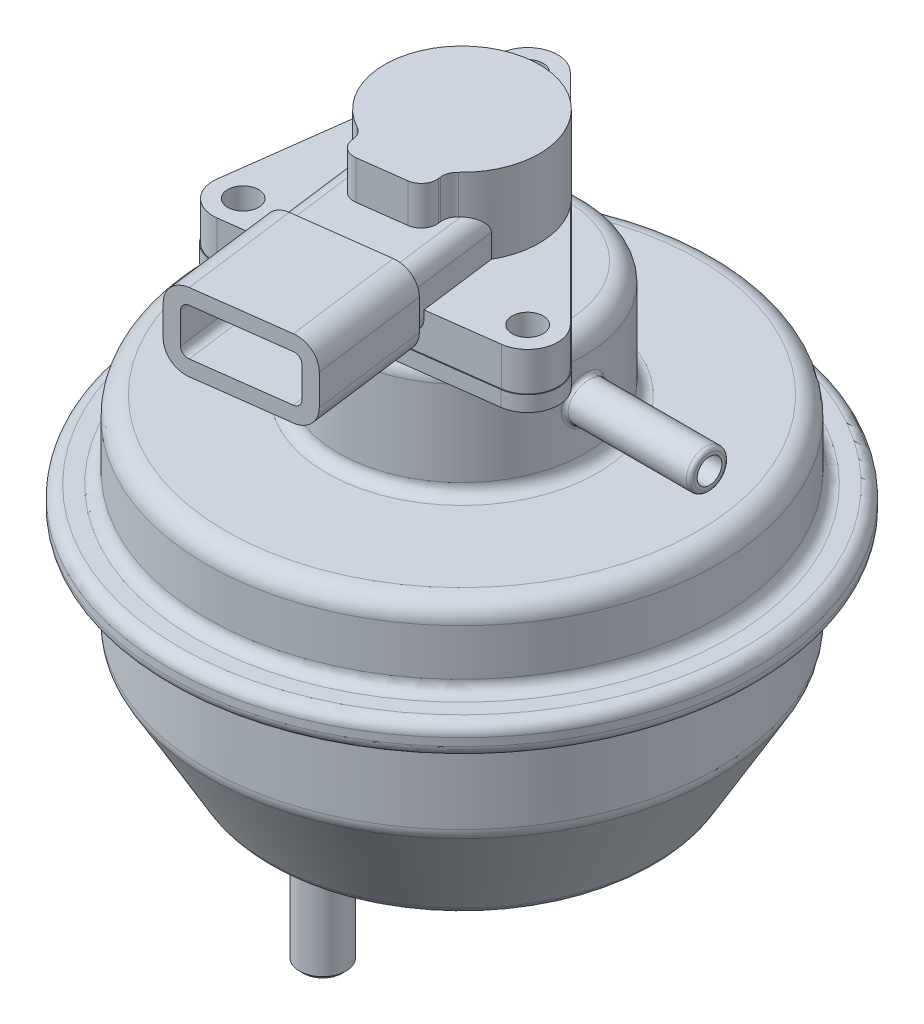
SolidWorks part; units mm, degrees
ref_plane "Plan de face" through (0, 0, 0) normal (0, 0, 1) x (1, 0, 0)
ref_plane "Plan de dessus" through (0, 0, 0) normal (0, 1, 0) x (1, 0, 0)
ref_plane "Plan de droite" through (0, 0, 0) normal (1, 0, 0) x (0, 0, -1)
sketch "Esquisse1" plane through (0, 0, 0) normal (0, 0, 1) x (1, 0, 0)
  line L0 (0, -17.0631) -> (0, 71.3623) construction
  line L1 (0, 0) -> (9, 0)
  line L2 (9, 0) -> (9, 8)
  line L3 (9, 8) -> (24.3397, 8)
  line L4 (24.3397, 8) -> (33, 23)
  line L5 (33, 23) -> (33, 37)
  line L6 (33, 37) -> (35, 37)
  line L7 (35, 37) -> (35, 35)
  line L8 (35, 35) -> (38, 35)
  line L9 (38, 35) -> (38, 39)
  line L10 (38, 39) -> (33, 39)
  line L11 (33, 39) -> (33, 49)
  line L12 (33, 49) -> (16, 49)
  line L13 (16, 49) -> (16, 64)
  line L14 (16, 64) -> (0, 64)
  line L15 (0, 64) -> (0, 63)
  line L16 (0, 63) -> (15, 63)
  line L17 (15, 63) -> (15, 48)
  line L18 (15, 48) -> (32, 48)
  line L19 (32, 48) -> (32, 23.2679)
  line L20 (32, 23.2679) -> (23.7624, 9)
  line L21 (23.7624, 9) -> (0, 9)
  line L22 (0, 9) -> (0, 0)
  dimension "D1" = 66
  dimension "D2" = 1
  dimension "D3" = 1
  dimension "D4" = 1
  dimension "D5" = 1
  dimension "D6" = 1
  dimension "D7" = 1
  dimension "D8" = 2
  dimension "D9" = 2
  dimension "D10" = 5
  dimension "D11" = 4
  dimension "D12" = 32
  dimension "D13" = 41
  dimension "D14" = 8
  dimension "D15" = 18
  dimension "D16" = 15
  dimension "D17" = 15
  dimension "D18" = 10
  dimension "D19" = 30
revolve "Révolution1" add sketch "Esquisse1" angle 360 about L0
fillet "Congé1" radius 1.5 10 edges at (0, 48, -32) (0, 63, -15) (0, 37, -33) (0, 8, -9) (0, 9, -23.7624) (0, 23.2679, -32) (0, 39, -33) (0, 49, -16) (0, 35, -38) (0, 39, -38)
fillet "Congé2" radius 2.5 6 edges at (0, 0, -9) (0, 8, -24.3397) (0, 23, -33) (0, 49, -33) (0, 48, -15) (0, 64, -16)
sketch "Esquisse2" plane through (0, 0, 0) normal (0, -1, 0) x (1, 0, 0)
  circle A0 centre (0, 0) radius 5.5
  dimension "D1" = 11
extrude "Enlèv. mat.-Extru.1" cut sketch "Esquisse2" against normal blind 1
sketch "Esquisse3" plane through (0, 1, 0) normal (0, -1, 0) x (1, 0, 0)
  circle A0 centre (0, 0) radius 3
  dimension "D1" = 6
extrude "Enlèv. mat.-Extru.2" cut sketch "Esquisse3" against normal up to next
ref_plane "Plan1" through (32, 0, 0) normal (1, 0, 0) x (0, 0, -1)
sketch "Esquisse4" plane through (32, 0, 0) normal (1, 0, 0) x (0, 0, -1)
  line L0 (13.5, 64) -> (-13.5, 64) construction
  circle A0 centre (0, 56.5) radius 2.5
  dimension "D1" = 5
  dimension "D2" = 7.5
extrude "Extrusion1" add sketch "Esquisse4" against normal up to next
sketch "Esquisse5" plane through (32, 0, 0) normal (1, 0, 0) x (0, 0, -1)
  circle A0 centre (0, 56.5) radius 1.6
  dimension "D1" = 3.2
extrude "Enlèv. mat.-Extru.3" cut sketch "Esquisse5" against normal up to next
fillet "Congé3" radius 0.5 2 edges at (15.8127, 55.959, 2.4408) (32, 56.5, -2.5)
sketch "Esquisse7" plane through (0, 0, 0) normal (1, 0, 0) x (0, 0, -1)
  line L0 (6.0798, 25.209) -> (27.2265, 13) construction
  line L1 (41.8, 0) -> (-41.8, 0) construction
  line L2 (25.0614, 9.25) -> (32.6651, 22.4199) construction
  line L3 (-22.8964, 8) -> (22.8964, 8) construction
  line L4 (24.6284, 14.5) -> (25.8784, 16.6651)
  line L5 (25.8784, 16.6651) -> (31.0746, 13.6651)
  line L6 (31.0746, 13.6651) -> (29.8246, 11.5)
  line L7 (29.8246, 11.5) -> (24.6284, 14.5)
  dimension "D1" = 30
  dimension "D2" = 5
  dimension "D3" = 2.5
  dimension "D4" = 3
  dimension "D5" = 6
revolve "Enlèvement de matière-Révolution1" cut sketch "Esquisse7" angle 360 about L0
sketch "Esquisse8" plane through (0, 8, 0) normal (0, -1, 0) x (1, 0, 0)
  line L0 (0, 18) -> (0, -18) construction
  circle A0 centre (0, 18) radius 3
  circle A1 centre (0, -18) radius 3
  dimension "D1" = 6
  dimension "D2" = 6
  dimension "D3" = 36
extrude "Extrusion2" add sketch "Esquisse8" along normal blind 13.5
chamfer "Chanfrein1" distance 0.5 angle 45 2 edges at (0, -5.5, -21) (0, -5.5, 15)
sketch "Esquisse9" plane through (0, 64, 0) normal (0, 1, 0) x (-1, 0, 0)
  line L0 (9.8995, -18.3848) -> (-18.3848, 9.8995) construction
  line L1 (38.225, 0) -> (-38.225, 0) construction
  line L2 (-4.2426, -4.2426) -> (14.1421, 14.1421) construction
  line L3 (7.0711, -21.2132) -> (-21.2132, 7.0711)
  line L4 (-18.9021, 13.8659) -> (13.6248, 18.1085)
  line L5 (18.1085, 13.6248) -> (13.8659, -18.9021)
  arc A0 (7.0711, -21.2132) -> (13.8659, -18.9021) centre (9.8995, -18.3848) ccw
  arc A1 (-18.9021, 13.8659) -> (-21.2132, 7.0711) centre (-18.3848, 9.8995) ccw
  arc A2 (18.1085, 13.6248) -> (13.6248, 18.1085) centre (14.1421, 14.1421) ccw
  circle A5 centre (-18.3848, 9.8995) radius 2
  circle A6 centre (14.1421, 14.1421) radius 2
  circle A7 centre (9.8995, -18.3848) radius 2
  dimension "D2" = 40
  dimension "D3" = 20
  dimension "D4" = 4
  dimension "D5" = 4
  dimension "D6" = 4
  dimension "D8" = 4
  dimension "D9" = 4
  dimension "D10" = 4
  dimension "D1" = 45
  dimension "D7" = 6
extrude "Extrusion3" add sketch "Esquisse9" along normal blind 2
sketch "Esquisse10" plane through (0, 66, 0) normal (0, 1, 0) x (-1, 0, 0)
  line L6 (-21.1425, 7.1418) -> (7.1418, -21.1425)
  line L7 (13.7667, -18.8892) -> (18.0094, 13.6377)
  line L8 (13.6377, 18.0094) -> (-18.8892, 13.7667)
  line L9 (-21.1425, 7.1418) -> (7.1418, -21.1425)
  line L10 (13.7667, -18.8892) -> (18.0094, 13.6377)
  line L11 (13.6377, 18.0094) -> (-18.8892, 13.7667)
  circle A0 centre (14.1421, 14.1421) radius 2 construction
  circle A1 centre (-18.3848, 9.8995) radius 2 construction
  circle A2 centre (9.8995, -18.3848) radius 2 construction
  circle A9 centre (14.1421, 14.1421) radius 2
  circle A10 centre (-18.3848, 9.8995) radius 2
  circle A11 centre (9.8995, -18.3848) radius 2
  arc A12 (-18.8892, 13.7667) -> (-21.1425, 7.1418) centre (-18.3848, 9.8995) ccw
  arc A13 (7.1418, -21.1425) -> (13.7667, -18.8892) centre (9.8995, -18.3848) ccw
  arc A14 (18.0094, 13.6377) -> (13.6377, 18.0094) centre (14.1421, 14.1421) ccw
  arc A15 (-18.8892, 13.7667) -> (-21.1425, 7.1418) centre (-18.3848, 9.8995) ccw
  arc A16 (7.1418, -21.1425) -> (13.7667, -18.8892) centre (9.8995, -18.3848) ccw
  arc A17 (18.0094, 13.6377) -> (13.6377, 18.0094) centre (14.1421, 14.1421) ccw
  dimension "D1" = 0.1
extrude "Extrusion4" add sketch "Esquisse10" along normal blind 5
sketch "Esquisse11" plane through (0, 71, 0) normal (0, 1, 0) x (-1, 0, 0)
  line L0 (0, 0) -> (-2.0816, 15.959) construction
  line L3 (13.6377, 18.0094) -> (-18.8892, 13.7667) construction
  line L4 (13.6377, 18.0094) -> (-18.8892, 13.7667) construction
  line L5 (-6.0781, 7.9408) -> (-6.5101, 11.2525)
  line L6 (-6.5101, 11.2525) -> (3.4059, 12.5459)
  line L7 (3.4059, 12.5459) -> (3.8379, 9.2342)
  arc A0 (-6.0781, 7.9408) -> (3.8379, 9.2342) centre (0, 0) ccw
  dimension "D1" = 20
  dimension "D2" = 10
  dimension "D3" = 12
extrude "Extrusion5" add sketch "Esquisse11" along normal blind 10
fillet "Congé4" radius 2 4 edges at (6.0781, 76, 7.9408) (6.5101, 76, 11.2525) (-3.4059, 76, 12.5459) (-3.8379, 76, 9.2342)
sketch "Esquisse12" plane through (2.0816, 0, 15.959) normal (0.1293, 0, 0.9916) x (0.9916, 0, -0.1293)
  line L0 (-15.8525, 66) -> (16.95, 66) construction
  line L1 (-8, 76) -> (8, 76)
  line L2 (-8, 76) -> (-8, 68)
  line L3 (-8, 68) -> (8, 68)
  line L4 (8, 76) -> (8, 68)
  line L5 (0, 0) -> (0, 76) construction
  dimension "D1" = 16
  dimension "D2" = 8
  dimension "D3" = 2
extrude "Extrusion6" add sketch "Esquisse12" against normal up to next and the other way blind 2
fillet "Congé5" radius 2 4 edges at (10.1438, 68, 15.9159) (-5.7219, 68, 17.9853) (9.491, 76, 10.9112) (-6.3746, 76, 12.9806)
sketch "Esquisse13" plane through (2.3403, 0, 17.9422) normal (0.1293, 0, 0.9916) x (0.9916, 0, -0.1293)
  line L8 (6, 77) -> (-6, 77)
  line L9 (-9, 74) -> (-9, 70)
  line L10 (-6, 67) -> (6, 67)
  line L11 (9, 70) -> (9, 74)
  line L12 (6, 77) -> (-6, 77)
  line L13 (-9, 74) -> (-9, 70)
  line L14 (-6, 67) -> (6, 67)
  line L15 (9, 70) -> (9, 74)
  line L20 (-7, 74) -> (-7, 70)
  line L21 (-6, 69) -> (6, 69)
  line L22 (7, 70) -> (7, 74)
  line L23 (6, 75) -> (-6, 75)
  line L24 (-7, 74) -> (-7, 70)
  line L25 (-6, 69) -> (6, 69)
  line L26 (7, 70) -> (7, 74)
  line L27 (6, 75) -> (-6, 75)
  arc A8 (-6, 77) -> (-9, 74) centre (-6, 74) ccw
  arc A9 (-9, 70) -> (-6, 67) centre (-6, 70) ccw
  arc A10 (6, 67) -> (9, 70) centre (6, 70) ccw
  arc A11 (9, 74) -> (6, 77) centre (6, 74) ccw
  arc A12 (-6, 77) -> (-9, 74) centre (-6, 74) ccw
  arc A13 (-9, 70) -> (-6, 67) centre (-6, 70) ccw
  arc A14 (6, 67) -> (9, 70) centre (6, 70) ccw
  arc A15 (9, 74) -> (6, 77) centre (6, 74) ccw
  arc A20 (-6, 75) -> (-7, 74) centre (-6, 74) ccw
  arc A21 (-7, 70) -> (-6, 69) centre (-6, 70) ccw
  arc A22 (6, 69) -> (7, 70) centre (6, 70) ccw
  arc A23 (7, 74) -> (6, 75) centre (6, 74) ccw
  arc A24 (-6, 75) -> (-7, 74) centre (-6, 74) ccw
  arc A25 (-7, 70) -> (-6, 69) centre (-6, 70) ccw
  arc A26 (6, 69) -> (7, 70) centre (6, 70) ccw
  arc A27 (7, 74) -> (6, 75) centre (6, 74) ccw
  dimension "D1" = 1
  dimension "D2" = 1
extrude "Extrusion7" add sketch "Esquisse13" along normal blind 15
sketch "Esquisse14" plane through (2.3403, 0, 17.9422) normal (0.1293, 0, 0.9916) x (0.9916, 0, -0.1293)
  line L0 (-7, 72) -> (7, 72) construction
  line L1 (-7, 74) -> (-7, 70) construction
  line L2 (7, 70) -> (7, 74) construction
  line L3 (0, 75) -> (0, 69) construction
  line L4 (6, 75) -> (-6, 75) construction
  line L5 (-6, 69) -> (6, 69) construction
  line L7 (-1.5, 72.5) -> (1.5, 72.5)
  line L8 (-1.5, 72.5) -> (-1.5, 71.5)
  line L9 (-1.5, 71.5) -> (1.5, 71.5)
  line L10 (1.5, 72.5) -> (1.5, 71.5)
  line L11 (-6, 72.5) -> (-3, 72.5)
  line L12 (-6, 72.5) -> (-6, 71.5)
  line L13 (-6, 71.5) -> (-3, 71.5)
  line L14 (-3, 72.5) -> (-3, 71.5)
  line L15 (3, 72.5) -> (6, 72.5)
  line L16 (3, 72.5) -> (3, 71.5)
  line L17 (3, 71.5) -> (6, 71.5)
  line L18 (6, 72.5) -> (6, 71.5)
  dimension "D1" = 3
  dimension "D2" = 1
  dimension "D3" = 1.5
  dimension "D4" = 1.5
extrude "Extrusion8" add sketch "Esquisse14" along normal blind 10
chamfer "Chanfrein2" distance 0.25 angle 45 12 edges at (8.0959, 72.5, 27.2762) (9.5833, 72, 27.0822) (8.0959, 71.5, 27.2762) (6.6085, 72, 27.4702) (-0.8285, 72.5, 28.4403) (0.6589, 72, 28.2463) (-0.8285, 71.5, 28.4403) (-2.3159, 72, 28.6343) (3.6337, 72.5, 27.8582) (5.1211, 72, 27.6642) (3.6337, 71.5, 27.8582) (2.1463, 72, 28.0522)
